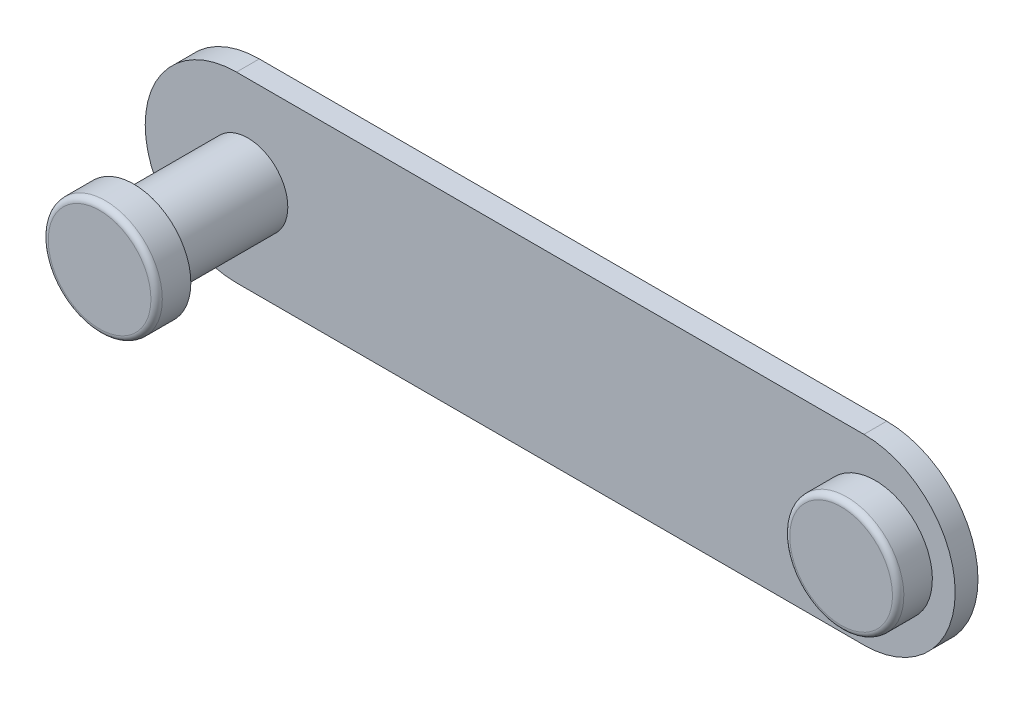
SolidWorks part; units mm, degrees
ref_plane "正面" through (0, 0, 0) normal (0, 0, 1) x (1, 0, 0)
ref_plane "平面" through (0, 0, 0) normal (0, 1, 0) x (1, 0, 0)
ref_plane "右側面" through (0, 0, 0) normal (1, 0, 0) x (0, 0, -1)
ref_plane "平面1" through (0, 0, 0) normal (0, 0, 1) x (1, 0, 0)
sketch "ｽｹｯﾁ1" plane through (0, 0, 0) normal (0, 0, 1) x (1, 0, 0)
  line L0 (-56, -8) -> (-1, -8)
  line L1 (-1, 8) -> (-56, 8)
  arc A0 (-56, 8) -> (-56, -8) centre (-56, 0) ccw
  arc A1 (-1, -8) -> (-1, 8) centre (-1, 0) ccw
extrude "押し出し1" add sketch "ｽｹｯﾁ1" along normal blind 2
ref_plane "平面2" through (0, 0, 0) normal (1, 0, 0) x (0, 0, -1)
sketch "ｽｹｯﾁ2" plane through (0, 0, 0) normal (1, 0, 0) x (0, 0, -1)
  line L0 (-5, 0) -> (-5, 4.5)
  line L1 (-4.5, 5) -> (-2, 5)
  line L2 (-2, 5) -> (-2, 3.6)
  line L3 (-2, 3.6) -> (0, 3.6)
  line L4 (0, 3.6) -> (0, 0)
  line L5 (0, 0) -> (-5, 0)
  line L6 (-2, 0) -> (-5, 0) construction
  arc A0 (-5, 4.5) -> (-4.5, 5) centre (-4.5, 4.5) cw
revolve "回転1" add sketch "ｽｹｯﾁ2" angle 360 about L6
ref_plane "平面3" through (0, 0, 0) normal (0, 1, 0) x (-1, 0, 0)
sketch "ｽｹｯﾁ3" plane through (0, 0, 0) normal (0, 1, 0) x (-1, 0, 0)
  line L0 (55, 15) -> (59.5, 15)
  line L1 (60, 14.5) -> (60, 12)
  line L2 (60, 12) -> (58.5, 12)
  line L3 (58.5, 12) -> (58.5, 2)
  line L4 (58.5, 2) -> (55, 2)
  line L5 (55, 2) -> (55, 15)
  line L6 (55, 2) -> (55, 15) construction
  arc A0 (59.5, 15) -> (60, 14.5) centre (59.5, 14.5) cw
revolve "回転2" add sketch "ｽｹｯﾁ3" angle 360 about L6
